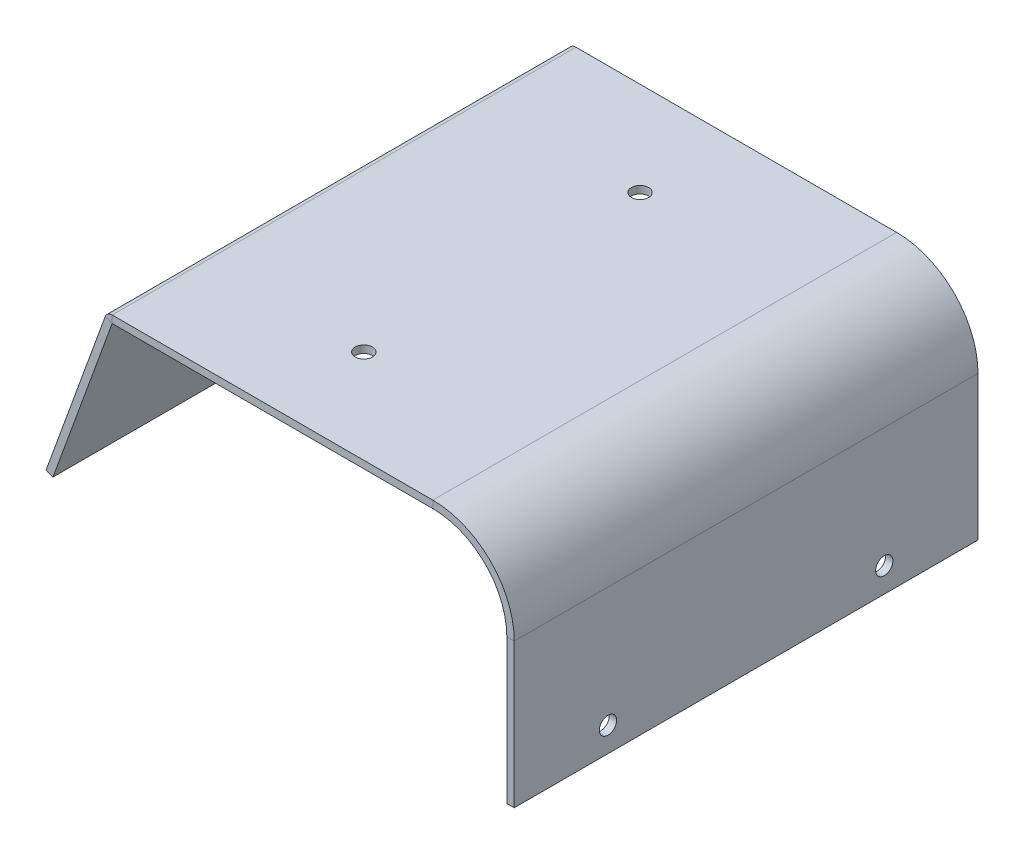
SolidWorks part; units mm, degrees
ref_plane "Front Plane" through (0, 0, 0) normal (0, 0, 1) x (1, 0, 0)
ref_plane "Top Plane" through (0, 0, 0) normal (0, 1, 0) x (1, 0, 0)
ref_plane "Right Plane" through (0, 0, 0) normal (1, 0, 0) x (0, 0, -1)
sketch "Sketch1" plane through (0, 0, 0) normal (0, 1, 0) x (1, 0, 0)
  line L0 (150, 94) -> (150, 0) construction
  line L1 (0, 0) -> (155, 0)
  line L2 (0, 0) -> (0, 94)
  line L3 (0, 94) -> (155, 94)
  line L4 (155, 0) -> (155, 94)
  line L5 (68, 94) -> (68, 0) construction
  line L7 (155, 47) -> (0, 47) construction
  circle A0 centre (68, 75) radius 1.75
  circle A1 centre (150, 75) radius 1.75
  circle A2 centre (150, 19) radius 1.75
  circle A3 centre (68, 19) radius 1.75
  dimension "D3" = 28
  dimension "D4" = 28
  dimension "D5" = 28
  dimension "D6" = 28
  dimension "D9" = 3.5
  dimension "D1" = 155
  dimension "D2" = 94
  dimension "D7" = 5
  dimension "D8" = 68
sheet metal parameters "Sheet-Metal1" thickness 1.5 parameters "D1"=0.7366
base flange "Base-Flange1" sketch "Sketch1" thickness 1.5 reverse thickness direction no parameters "D1"=0.7366
sketch "Sketch3" plane through (0, 0, 0) normal (0, 1, 0) x (1, 0, 0)
  line L0 (36, 94) -> (36, 0)
  line L1 (155, 94) -> (0, 94) construction
  line L2 (0, 0) -> (155, 0) construction
  line L3 (0, 94) -> (0, 0) construction
  dimension "D1" = 36
sketched bend "Sketched Bend1" parameters "D1"=0.001
bend "SketchBend1" bend radius 0.001 bend angle 70 parameters "D5"=1
sketch "Sketch4" plane through (0, 0, 0) normal (0, 1, 0) x (1, 0, 0)
  line L0 (101, 94) -> (101, 0)
  line L1 (155, 94) -> (36, 94) construction
  line L2 (36, 0) -> (155, 0) construction
  line L3 (155, 0) -> (155, 94) construction
  dimension "D1" = 54
sketched bend "Sketched Bend2" parameters "D1"=15
bend "SketchBend2" bend radius 15 bend angle 90 parameters "D5"=2
flat pattern "Flat-Pattern1"
sketch "Bend-Lines1" plane through (0, -1.5, 0) normal (0, -1, 0) x (1, 0, 0)
  line L0 (113.37, -94) -> (113.37, 0) construction
  line L1 (35.5412, -94) -> (35.5412, 0) construction
sketch3d "Bounding-Box1" [suppressed]
  line L0 (155, 0, 0) -> (0, 0, 0) construction
  line L1 (155, 94, 0) -> (0, 94, 0) construction
  line L2 (155, 0, 0) -> (155, 94, 0) construction
  line L3 (0, 0, 0) -> (0, 94, 0) construction
bend of the flat pattern "Flatten-<SketchBend1>1"
bend of the flat pattern "Flatten-<SketchBend2>1"
